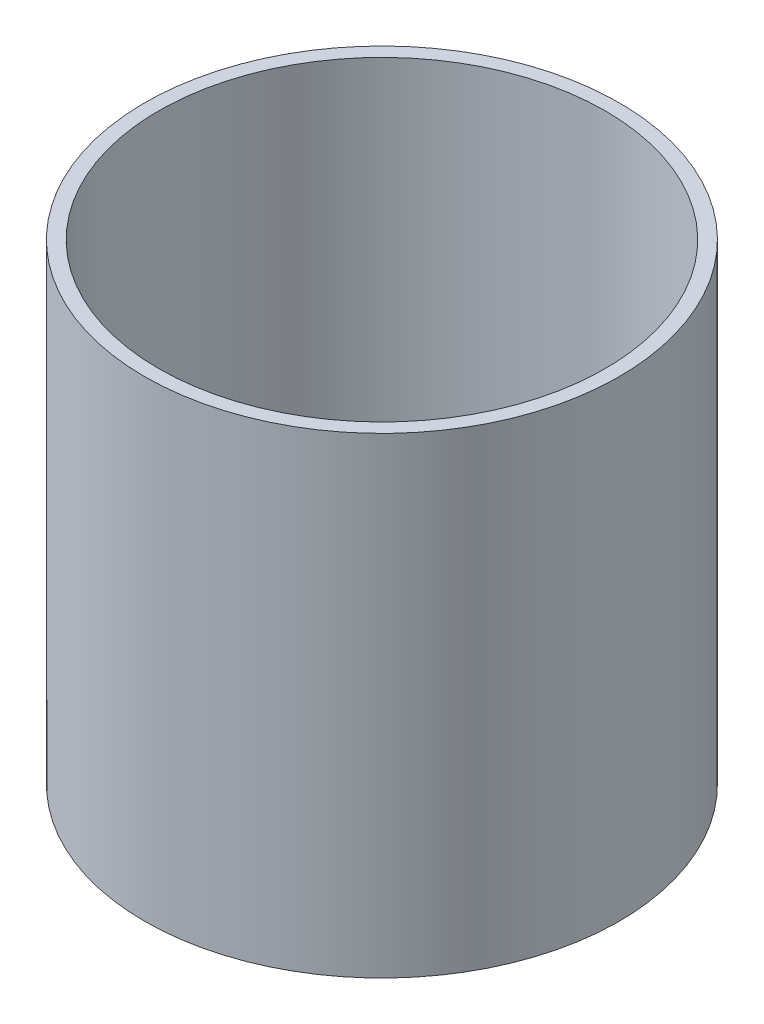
SolidWorks part; units mm, degrees
ref_plane "Alzado" through (0, 0, 0) normal (0, 0, 1) x (1, 0, 0)
ref_plane "Planta" through (0, 0, 0) normal (0, 1, 0) x (1, 0, 0)
ref_plane "Vista lateral" through (0, 0, 0) normal (1, 0, 0) x (0, 0, -1)
sketch "Croquis1" plane through (0, 0, 0) normal (1, 0, 0) x (0, 0, -1)
  line L0 (800, 43.3301) -> (800, -1626.6699)
  line L2 (850, -1646.6699) -> (850, 43.3301)
  line L3 (850, 43.3301) -> (800, 43.3301)
  line L4 (0, 0) -> (0, -1932.1368) construction
  line L5 (850, -1646.6699) -> (0, -1646.6699)
  line L6 (0, -1646.6699) -> (0, -1626.6699)
  line L7 (0, -1626.6699) -> (800, -1626.6699)
  dimension "D1" = 50
  dimension "D2" = 1690
  dimension "D3" = 800
  dimension "D4" = 20
revolve "Revolución1" add sketch "Croquis1" angle 360 about L4
